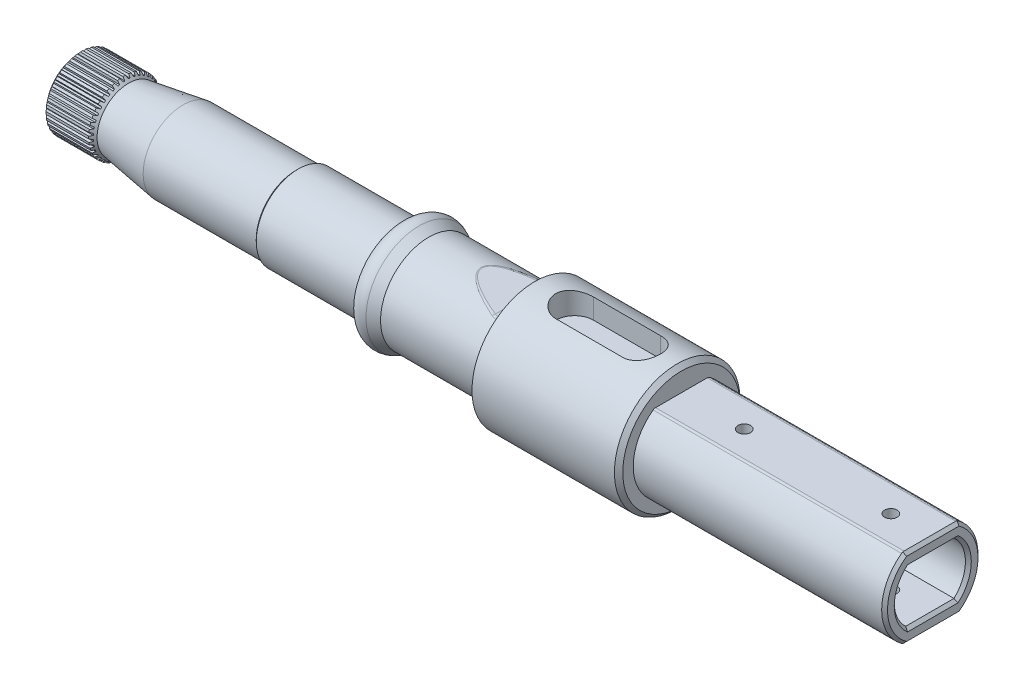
SolidWorks part; units mm, degrees
ref_plane "Plane1" through (0, 0, 0) normal (0, 0, 1) x (1, 0, 0)
ref_plane "Plane2" through (0, 0, 0) normal (0, 1, 0) x (1, 0, 0)
ref_plane "Plane3" through (0, 0, 0) normal (1, 0, 0) x (0, 0, -1)
sketch "Esquisse1" plane through (0, 0, 0) normal (0, 0, 1) x (1, 0, 0)
  line L0 (0, 7.5) -> (0.8083, 8.5)
  line L1 (0.8083, 8.5) -> (11, 8.5)
  line L2 (11, 8.5) -> (12, 7.5)
  line L3 (12, 7.5) -> (25, 9.5)
  line L4 (25, 9.5) -> (52, 9.5)
  line L5 (52, 9.5) -> (52.5, 10)
  line L6 (52.5, 10) -> (76.5359, 10)
  line L7 (204, 11.5) -> (204, 0)
  line L8 (204, 0) -> (0, 0)
  line L9 (0, 0) -> (0, 7.5)
  line L10 (-8, 0) -> (9, 0) construction
  line L12 (83.668, 11.5) -> (204, 11.5)
  line L13 (77.4019, 11.5) -> (76.5359, 10)
  line L14 (81.3602, 12.6739) -> (83.668, 11.5)
  arc A0 (81.3602, 12.6739) -> (77.4019, 11.5) centre (80, 10) ccw
  dimension "D1" = 11
  dimension "D2" = 1
  dimension "D3" = 8.5
  dimension "D4" = 7.5
  dimension "D5" = 9.5
  dimension "D6" = 10
  dimension "D7" = 0.5
  dimension "D8" = 25
  dimension "D9" = 52
  dimension "D10" = 204
  dimension "D11" = 11.5
revolve "Base-Révolution" add sketch "Esquisse1" angle 360 about L10
ref_plane "Plan4" through (0, 0, 12) normal (0, 0, 1) x (1, 0, 0)
sketch "Esquisse2" plane through (0, 0, 12) normal (0, 0, 1) x (1, 0, 0)
  line L0 (204, -11.5) -> (204, 11.5) construction
  line L1 (208, 9.5) -> (106.4075, 9.5)
  line L2 (208, 9.5) -> (208, 13)
  line L3 (89, 13) -> (208, 13)
  line L4 (105.6009, -9.5822) -> (89, -13)
  line L5 (207, 0) -> (91, 0) construction
  line L6 (105.6009, 9.5822) -> (89, 13)
  line L7 (89, -13) -> (208, -13)
  line L8 (208, -9.5) -> (208, -13)
  line L9 (208, -9.5) -> (106.4075, -9.5)
  arc A0 (105.6009, 9.5822) -> (106.4075, 9.5) centre (106.4075, 13.5) ccw
  arc A1 (105.6009, -9.5822) -> (106.4075, -9.5) centre (106.4075, -13.5) cw
  point P11 (106, 9.5)
  dimension "D3" = 4
  dimension "D1" = 9.5
  dimension "D2" = 98
extrude "Enlèv. mat.-Extru.1" cut sketch "Esquisse2" against normal through all
sketch "Esquisse4" plane through (204, 0, 0) normal (1, 0, 0) x (0, 0, -1)
  line L3 (0, 0) -> (-18, 0) construction
  line L5 (-5.7609, 6.25) -> (5.7609, 6.25)
  line L8 (-5.7609, -6.25) -> (5.7609, -6.25)
  arc A2 (5.7609, -6.25) -> (5.7609, 6.25) centre (0, 0) ccw
  arc A3 (-5.7609, 6.25) -> (-5.7609, -6.25) centre (0, 0) ccw
  dimension "D1" = 17
  dimension "D2" = 6.25
  dimension "D3" = 6.25
extrude "Enlèv. mat.-Extru.3" cut sketch "Esquisse4" against normal blind 97
chamfer "Chanfrein4" distance 0.7 angle 45
fillet "Congé2" radius 1
sketch "Esquisse5" plane through (0, 0, 0) normal (0, 0, 1) x (1, 0, 0)
  line L0 (144, 8) -> (109, 8)
  line L1 (144, 8) -> (144, 15)
  line L2 (109, 15) -> (144, 15)
  line L3 (109, 15) -> (109, 8)
  line L4 (204, -8.8) -> (204, 8.8) construction
  line L5 (208.9571, 0) -> (99.4587, 0) construction
  line L7 (107, 0) -> (203.3, 0) construction
  dimension "D1" = 95
  dimension "D2" = 35
revolve "Boss.-Révol.1" add sketch "Esquisse5" angle 360 about L5
sketch "Esquisse6" plane through (0, 9.5, 0) normal (0, 1, 0) x (-1, 0, 0)
  line L1 (-134.5, -4.5) -> (-118.5, -4.5)
  line L3 (-118.5, 4.5) -> (-134.5, 4.5)
  arc A0 (-118.5, 4.5) -> (-118.5, -4.5) centre (-118.5, 0) cw
  arc A1 (-134.5, -4.5) -> (-134.5, 4.5) centre (-134.5, 0) cw
  dimension "D1" = 16
extrude "Enlèv. mat.-Extru.4" cut sketch "Esquisse6" along normal through all
pattern_circular "Répétition circulaire1" count 2 every 180
chamfer "Chanfrein5" distance 1 angle 45
sketch "Esquisse7" plane through (0, 9.5, 0) normal (0, 1, 0) x (-1, 0, 0)
  line L0 (-204, 0) -> (-203.3, 0) construction
  line L1 (-204, -6.261) -> (-204, 6.261) construction
  circle A0 centre (-194, 0) radius 1.5
  circle A1 centre (-159, 0) radius 1.5
  dimension "D1" = 3
  dimension "D2" = 3
  dimension "D3" = 10
  dimension "D4" = 45
extrude "Enlèv. mat.-Extru.5" cut sketch "Esquisse7" against normal through all
sketch "Esquisse8" plane through (0, 0, 0) normal (-1, 0, 0) x (0, 0, 1)
  line L0 (0, 0) -> (0, 15) construction
  line L1 (0, 17.2935) -> (0, 10.4131) construction
  line L2 (0, 0) -> (-2.5224, 15.926) construction
  line L3 (0, 0) -> (-1.1795, 14.987) construction
  line L4 (-0.205, 8.8718) -> (-0.4255, 7.9456)
  line L5 (-0.8228, 7.9143) -> (-0.4255, 7.9456)
  line L6 (-1.1854, 8.7946) -> (-0.8228, 7.9143)
  line L7 (-1.1854, 8.7946) -> (-0.205, 8.8718)
  point P10 (-0.6952, 8.8332)
  point P12 (-0.6952, 8.8332)
  point P14 (-0.6241, 7.93)
  dimension "D1" = 9
  dimension "D2" = 4.5
extrude "Enlèv. mat.-Extru.6" cut sketch "Esquisse8" against normal blind 12
pattern_circular "Répétition circulaire2" count 40 every 9 about axis through (-8, 0, 0) along (1, 0, 0)
sketch "Esquisse9" plane through (0, 0, 0) normal (-1, 0, 0) x (0, 0, 1)
  circle A0 centre (0, 0) radius 4.5
  dimension "D1" = 9
extrude "Enlèv. mat.-Extru.7" cut sketch "Esquisse9" against normal blind 40
